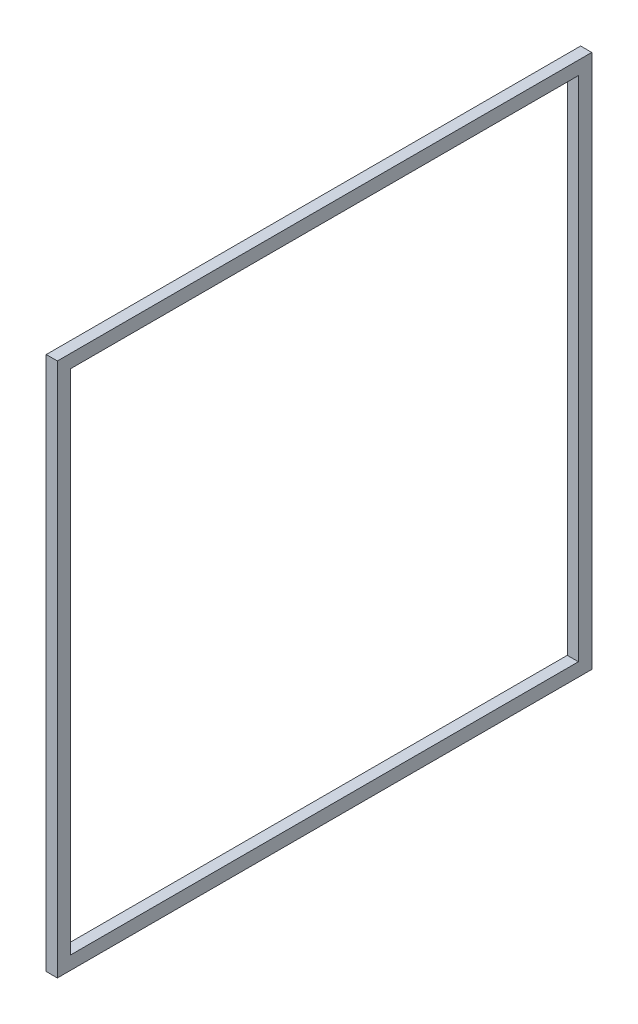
SolidWorks part; units mm, degrees
ref_plane "Front Plane" through (0, 0, 0) normal (1, 0, 0) x (0, 1, 0)
ref_plane "Top Plane" through (0, 0, 0) normal (0, 0, 1) x (0, 1, 0)
ref_plane "Right Plane" through (0, 0, 0) normal (0, 1, 0) x (-1, 0, 0)
sketch "Sketch1" plane through (0, 0, 0) normal (1, 0, 0) x (0, 1, 0)
  line L0 (-152.4, -152.4) -> (152.4, -152.4)
  line L1 (152.4, -152.4) -> (152.4, 152.4)
  line L2 (152.4, 152.4) -> (-152.4, 152.4)
  line L3 (-152.4, 152.4) -> (-152.4, -152.4)
  line L4 (-144.78, -144.78) -> (144.78, -144.78)
  line L5 (144.78, -144.78) -> (144.78, 144.78)
  line L6 (144.78, 144.78) -> (-144.78, 144.78)
  line L7 (-144.78, 144.78) -> (-144.78, -144.78)
extrude "Screen_retainer" add sketch "Sketch1" along normal blind 6.35
